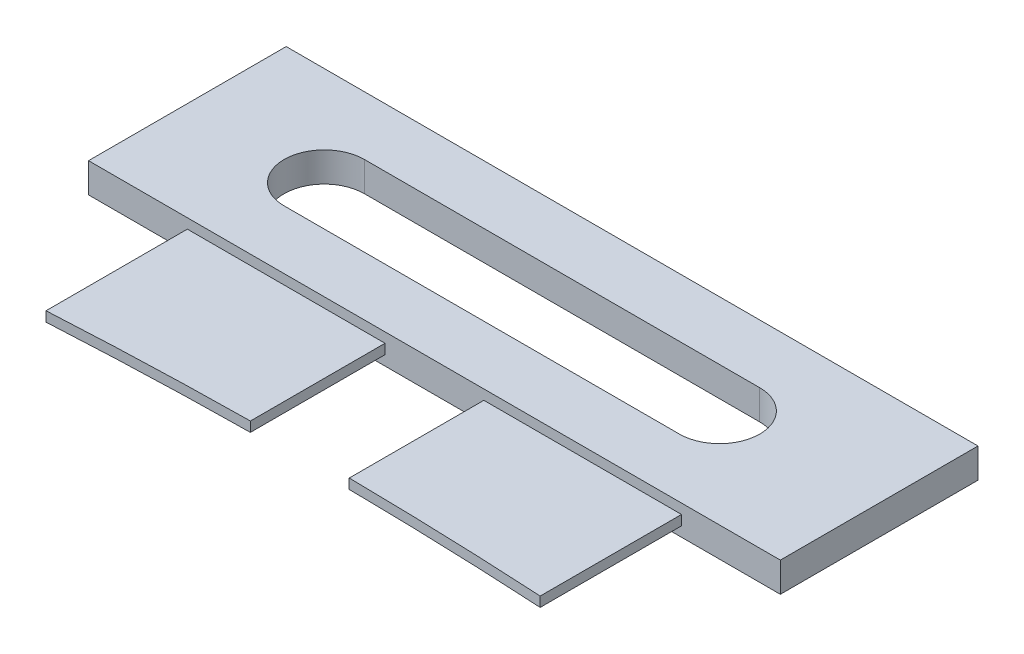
SolidWorks part; units mm, degrees
ref_plane "Front Plane" through (0, 0, 0) normal (0, 0, 1) x (1, 0, 0)
ref_plane "Top Plane" through (0, 0, 0) normal (0, 1, 0) x (1, 0, 0)
ref_plane "Right Plane" through (0, 0, 0) normal (1, 0, 0) x (0, 0, -1)
sketch "Sketch2" plane through (0, 0, -40) normal (0, 0, -1) x (-1, 0, 0)
  line L0 (-25, 0) -> (-25, -1) construction
  line L1 (-25, -1) -> (-5, -1) construction
  line L2 (-5, -1) -> (-5, 0) construction
  line L3 (-5, 0) -> (-25, 0) construction
  line L4 (5, 0) -> (5, -1) construction
  line L5 (5, -1) -> (25, -1) construction
  line L6 (25, -1) -> (25, 0) construction
  line L7 (25, 0) -> (5, 0) construction
  line L8 (-25, 0) -> (-25, -1)
  line L9 (-25, -1) -> (-5, -1)
  line L10 (-5, -1) -> (-5, 0)
  line L11 (-5, 0) -> (-25, 0)
  line L12 (5, 0) -> (5, -1)
  line L13 (5, -1) -> (25, -1)
  line L14 (25, -1) -> (25, 0)
  line L15 (25, 0) -> (5, 0)
extrude "Boss-Extrude1" add sketch "Sketch2" against normal up to surface (13.62 mm away)
sketch "Sketch3" plane through (0, 0, -40) normal (0, 0, -1) x (-1, 0, 0)
  line L0 (-25, 0) -> (-25, -1) construction
  line L1 (-35, 1) -> (35, 1)
  line L2 (-35, 1) -> (-35, -2)
  line L3 (-35, -2) -> (35, -2)
  line L4 (35, 1) -> (35, -2)
  point P4 (0, -2)
  point P6 (-35, -0.5)
  point P9 (-25, -0.5)
  dimension "D1" = 70
  dimension "D2" = 3
extrude "Boss-Extrude2" add sketch "Sketch3" along normal blind 20
sketch "Sketch4" plane through (0, 1, 0) normal (0, 1, 0) x (1, 0, 0)
  line L0 (-21.1477, 50) -> (18.8523, 50) construction
  line L1 (-21.1477, 54.0639) -> (18.8523, 54.0639)
  line L2 (-21.1477, 45.9361) -> (18.8523, 45.9361)
  line L3 (-35, 60) -> (-35, 40) construction
  arc A0 (-21.1477, 54.0639) -> (-21.1477, 45.9361) centre (-21.1477, 50) ccw
  arc A1 (18.8523, 45.9361) -> (18.8523, 54.0639) centre (18.8523, 50) ccw
  point P2 (-1.1477, 50)
  point P10 (-35, 50)
  dimension "D1" = 40
extrude "Cut-Extrude1" cut sketch "Sketch4" against normal through all
